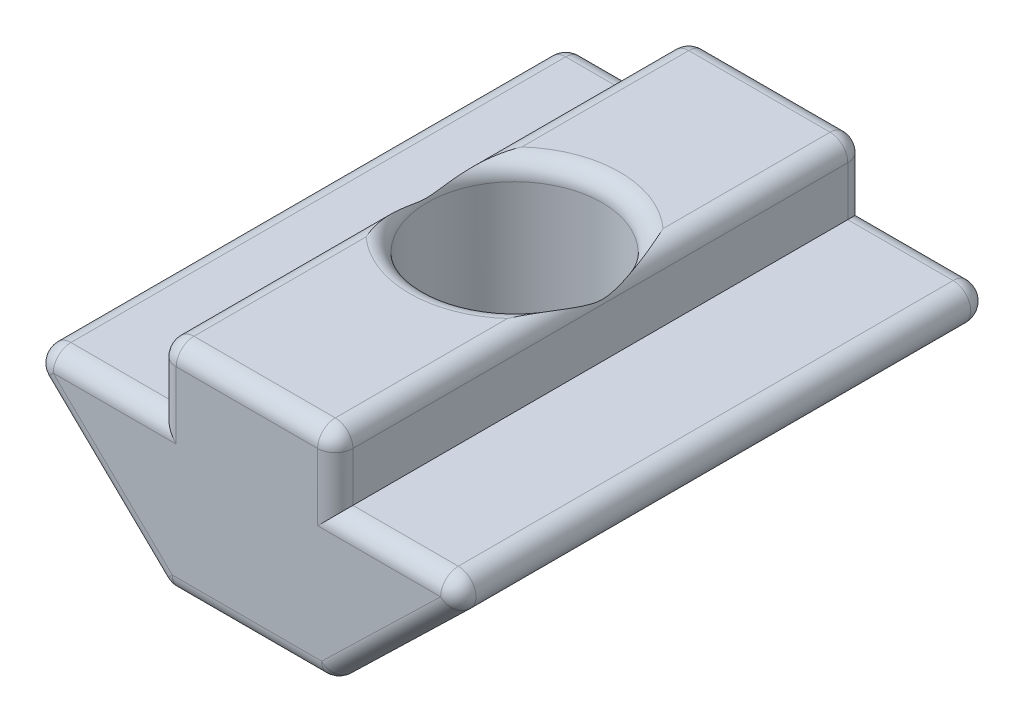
SolidWorks part; units mm, degrees
ref_plane "Front Plane" through (0, 0, 0) normal (0, 0, 1) x (1, 0, 0)
ref_plane "Top Plane" through (0, 0, 0) normal (0, 1, 0) x (1, 0, 0)
ref_plane "Right Plane" through (0, 0, 0) normal (1, 0, 0) x (0, 0, -1)
sketch "Sketch1" plane through (0, 0, 0) normal (0, 0, 1) x (1, 0, 0)
  line L0 (-5, 20) -> (-5, 16.2126)
  line L1 (-20, -20) -> (20, -20)
  line L2 (-20, -20) -> (-20, 20)
  line L3 (-20, 20) -> (20, 20)
  line L4 (20, -20) -> (20, 20)
  line L5 (-20, -20) -> (20, 20) construction
  line L6 (-20, 20) -> (20, -20) construction
  line L7 (-5, 16.2126) -> (-13.4323, 16.2126)
  line L8 (-13.4323, 16.2126) -> (-4.6312, 7.6894)
  line L9 (-4.6312, 7.6894) -> (0, 7.6894)
  line L10 (-7.6894, 4.6312) -> (-7.6894, 0)
  line L11 (-16.2126, 13.4323) -> (-7.6894, 4.6312)
  line L12 (-16.2126, 5) -> (-16.2126, 13.4323)
  line L13 (-20, 5) -> (-16.2126, 5)
  line L14 (0, 7.6894) -> (0, 16.8611) construction
  line L15 (0, 0) -> (-11.384, 0) construction
  line L16 (5, 20) -> (5, 16.2126)
  line L17 (5, 16.2126) -> (13.4323, 16.2126)
  line L18 (13.4323, 16.2126) -> (4.6312, 7.6894)
  line L19 (16.2126, 13.4323) -> (7.6894, 4.6312)
  line L20 (16.2126, 5) -> (16.2126, 13.4323)
  line L21 (20, 5) -> (16.2126, 5)
  line L22 (7.6894, 4.6312) -> (7.6894, 0)
  line L23 (4.6312, 7.6894) -> (0, 7.6894)
  line L24 (20, -5) -> (16.2126, -5)
  line L25 (16.2126, -5) -> (16.2126, -13.4323)
  line L26 (16.2126, -13.4323) -> (7.6894, -4.6312)
  line L27 (13.4323, -16.2126) -> (4.6312, -7.6894)
  line L28 (5, -16.2126) -> (13.4323, -16.2126)
  line L29 (5, -20) -> (5, -16.2126)
  line L30 (4.6312, -7.6894) -> (0, -7.6894)
  line L31 (7.6894, -4.6312) -> (7.6894, 0)
  line L32 (-5, -20) -> (-5, -16.2126)
  line L33 (-5, -16.2126) -> (-13.4323, -16.2126)
  line L34 (-13.4323, -16.2126) -> (-4.6312, -7.6894)
  line L35 (-16.2126, -13.4323) -> (-7.6894, -4.6312)
  line L36 (-16.2126, -5) -> (-16.2126, -13.4323)
  line L37 (-20, -5) -> (-16.2126, -5)
  line L38 (-7.6894, -4.6312) -> (-7.6894, 0)
  line L39 (-4.6312, -7.6894) -> (0, -7.6894)
  point P0 (0, 0)
  point P52 (0, 0)
  dimension "D1" = 40
  dimension "D2" = 40
  dimension "D4" = 15
  dimension "D3" = 4
extrude "Boss-Extrude1" add sketch "Sketch1" along normal blind 30 contours L23 L18 L17 L16 L3 L0 L7 L8 L9
sketch "Sketch2" plane through (0, 20, 0) normal (0, 1, 0) x (1, 0, 0)
  circle A0 centre (0, -14.8525) radius 4.95
  dimension "D1" = 9.9
extrude "Cut-Extrude2" cut sketch "Sketch2" against normal blind 30
fillet "Fillet1" radius 1 29 edges at (0, 20, 19.8025) (0, 7.6894, 19.8025) (0, 7.6894, 9.9025) (4.95, 7.9982, 14.8525) (0, 7.6894, 0) (9.0317, 11.951, 0) (9.2161, 16.2126, 0) (5, 18.1063, 0) (0, 20, 0) (-5, 18.1063, 0) (-9.2161, 16.2126, 0) (-9.0317, 11.951, 0) (0, 7.6894, 30) (9.0317, 11.951, 30) (9.2161, 16.2126, 30) (5, 18.1063, 30) (0, 20, 30) (-5, 18.1063, 30) (-9.2161, 16.2126, 30) (-4.6312, 7.6894, 6.5523) (-4.6312, 7.6894, 23.3001) (-13.4323, 16.2126, 15) (-5, 20, 15) (5, 20, 15) (13.4323, 16.2126, 15) (4.6312, 7.6894, 6.5523) (4.6312, 7.6894, 23.3001) (-4.95, 7.9982, 14.8525) (-9.0317, 11.951, 30)
